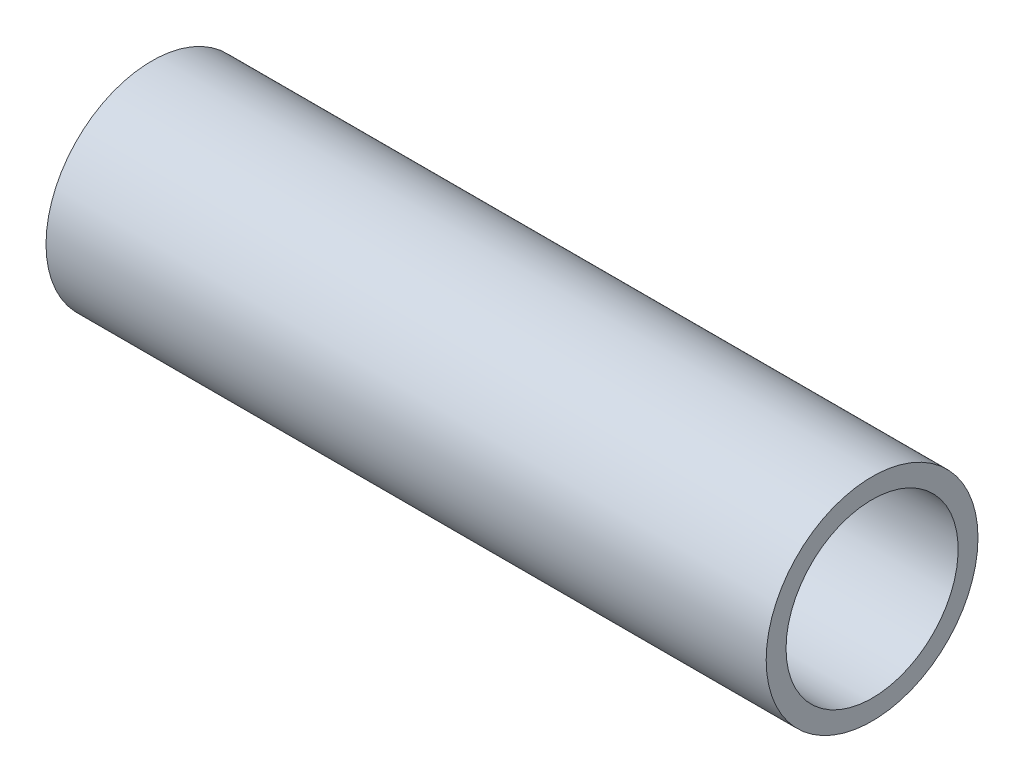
SolidWorks part; units mm, degrees
ref_plane "Plan de face" through (0, 0, 0) normal (0, 0, 1) x (1, 0, 0)
ref_plane "Plan de dessus" through (0, 0, 0) normal (0, 1, 0) x (1, 0, 0)
ref_plane "Plan de droite" through (0, 0, 0) normal (1, 0, 0) x (0, 0, -1)
sketch "Esquisse1" plane through (0, 0, 0) normal (0, 0, 1) x (1, 0, 0)
  line L1 (102, -154.574) -> (238, -154.574)
  line L2 (102, -154.574) -> (102, -150.824)
  line L3 (102, -150.824) -> (238, -150.824)
  line L4 (238, -154.574) -> (238, -150.824)
  line L7 (136.3348, -170.824) -> (188.7172, -170.824) construction
  dimension "D1" = 136
  dimension "D2" = 20
  dimension "D3" = 16.25
revolve "Révolution1" add sketch "Esquisse1" angle 360 about L7
